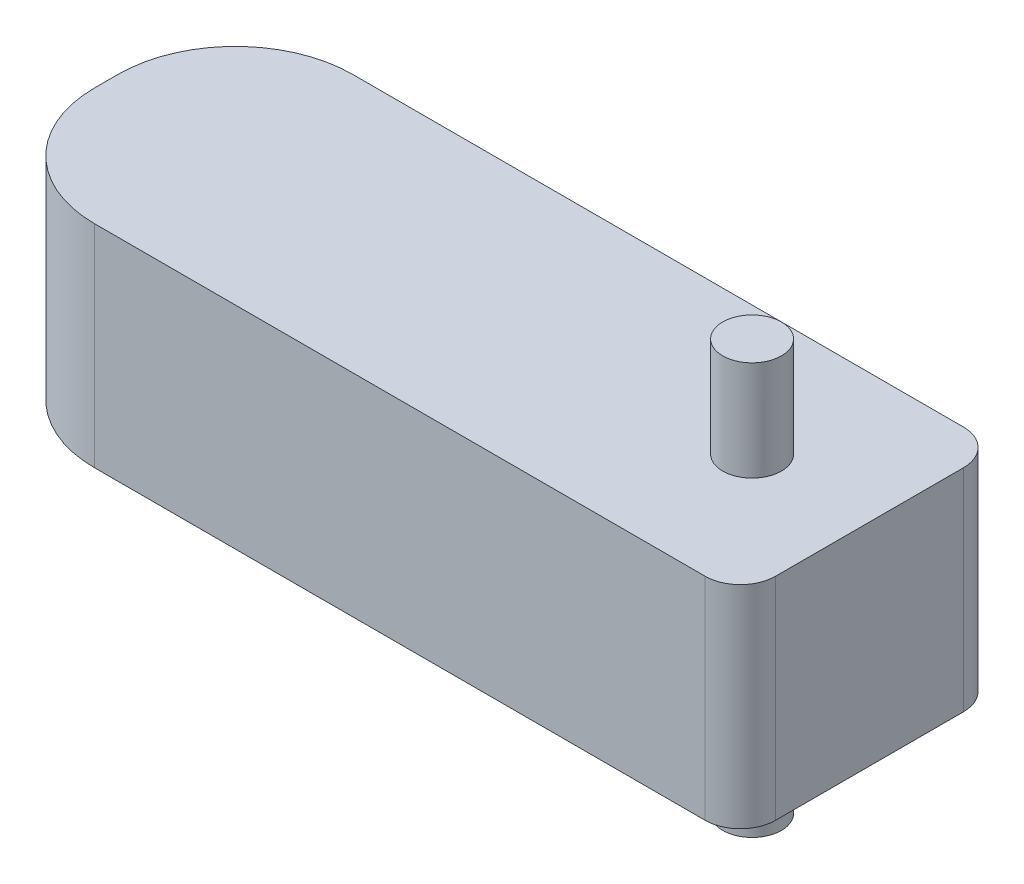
SolidWorks part; units mm, degrees
ref_plane "Front Plane" through (0, 0, 0) normal (0, 0, 1) x (1, 0, 0)
ref_plane "Top Plane" through (0, 0, 0) normal (0, 1, 0) x (1, 0, 0)
ref_plane "Right Plane" through (0, 0, 0) normal (1, 0, 0) x (0, 0, -1)
sketch "Sketch2" plane through (0, 0, 0) normal (0, 1, 0) x (1, 0, 0)
  line L1 (0, 0) -> (65, 0)
  line L2 (0, 0) -> (0, 22)
  line L3 (0, 22) -> (65, 22)
  line L4 (65, 0) -> (65, 22)
  dimension "D1" = 65
  dimension "D2" = 22
extrude "Boss-Extrude1" add sketch "Sketch2" along normal blind 18
sketch "Sketch3" plane through (0, 18, 0) normal (0, 1, 0) x (1, 0, 0)
  line L0 (65, 0) -> (65, 22) construction
  circle A0 centre (55, 11) radius 2.5
  dimension "D2" = 5
  dimension "D1" = 10
extrude "Boss-Extrude2" add sketch "Sketch3" along normal blind 8.5
sketch "Sketch4" plane through (0, 0, 0) normal (0, -1, 0) x (1, 0, 0)
  line L0 (65, 0) -> (65, -22) construction
  circle A0 centre (55, -11) radius 2.5
  dimension "D2" = 5
  dimension "D1" = 10
extrude "Boss-Extrude3" add sketch "Sketch4" along normal blind 8.5
fillet "Fillet1" radius 10 2 edges at (0, 9, 0) (0, 9, -22)
fillet "Fillet2" radius 3 2 edges at (65, 9, 0) (65, 9, -22)
